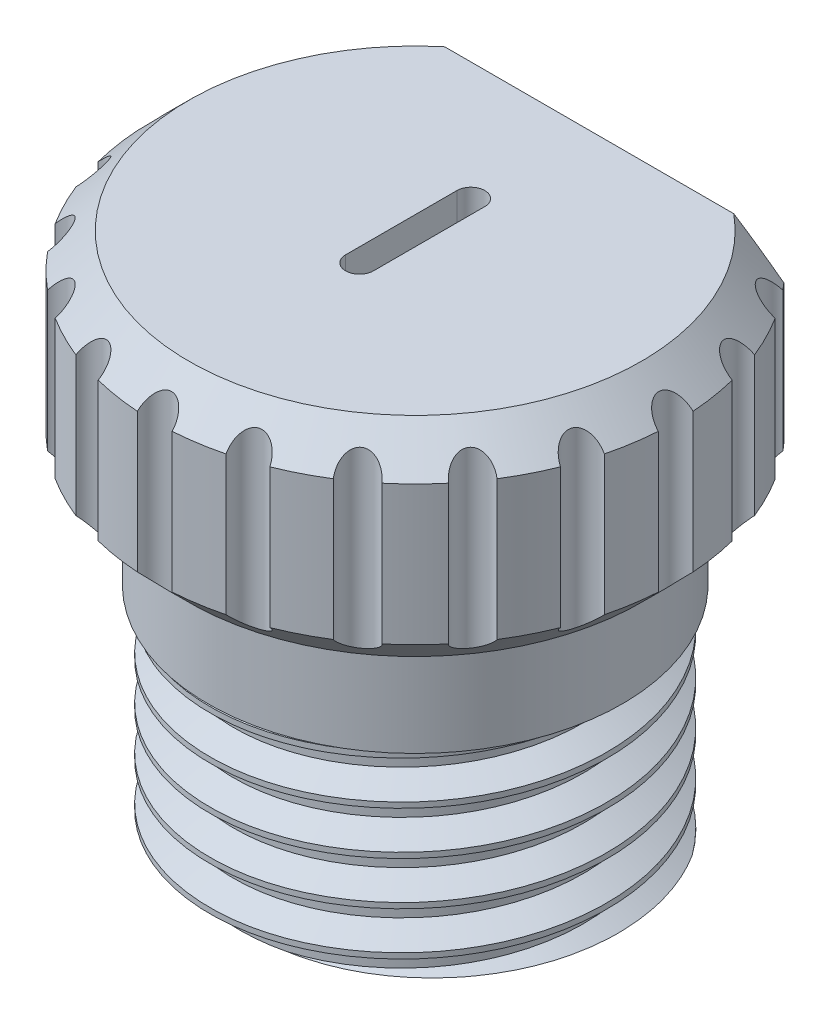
SolidWorks part; units mm, degrees
ref_plane "Front Plane" through (0, 0, 0) normal (0, 0, 1) x (1, 0, 0)
ref_plane "Top Plane" through (0, 0, 0) normal (0, 1, 0) x (1, 0, 0)
ref_plane "Right Plane" through (0, 0, 0) normal (1, 0, 0) x (0, 0, -1)
sketch "Sketch1" plane through (0, 0, 0) normal (0, 1, 0) x (1, 0, 0)
  circle A0 centre (0, 0) radius 7.239
  dimension "D1" = 14.478
extrude "Boss-Extrude1" add sketch "Sketch1" along normal blind 11.303
thread "Thread1" pitch 1.5875 start angle 0, offset 2.54, length 10.795, pitch 1.5875, diameter 14.478
ref_plane "Plane1" through (7.239, -2.54, 0) normal (0, 0, 1) x (1, 0, 0)
sketch "Thread Profile1" plane through (7.239, -2.54, 0) normal (0, 0, 1) x (1, 0, 0)
  line L0 (0, 0) -> (0, 1.5875) construction
  line L11 (0, 0) -> (0, 1.3891)
  line L12 (0, 1.3891) -> (-0.8593, 0.893)
  line L13 (-0.8593, 0.893) -> (-0.8593, 0.4961)
  line L15 (-0.8593, 0.4961) -> (0, 0)
  line L17 (-0.8593, 0.6945) -> (0, 0.6945) construction
  point P2 (0, 0)
  dimension "Pitch" = 1.5875
  dimension "Profile_Angle" = 60
  dimension "Profile_Land" = 0.3969
  dimension "Profile_Height" = 0.8593
sketch "Sketch4" plane through (0, 11.303, 0) normal (0, 1, 0) x (1, 0, 0)
  circle A0 centre (0, 0) radius 9.525
  dimension "D1" = 19.05
extrude "Boss-Extrude2" add sketch "Sketch4" along normal blind 7.62
sketch "Sketch5" plane through (0, 18.923, 0) normal (0, 1, 0) x (1, 0, 0)
  line L0 (0, -2.032) -> (0, 2.032) construction
  line L5 (-0.508, -2.032) -> (-0.508, 2.032)
  line L6 (0.508, -2.032) -> (0.508, 2.032)
  arc A0 (-0.508, -2.032) -> (0.508, -2.032) centre (0, -2.032) ccw
  arc A1 (0.508, 2.032) -> (-0.508, 2.032) centre (0, 2.032) ccw
  point P2 (0, 0)
  dimension "D1" = 1.016
  dimension "D2" = 4.064
extrude "Cut-Extrude1" cut sketch "Sketch5" against normal blind 3.81
chamfer "Chamfer1" distance 1.27 angle 45 1 edges at (0, 11.303, 9.525)
sketch "Sketch7" plane through (0, 0, 0) normal (0, -1, 0) x (1, 0, 0)
  line L0 (0, 0) -> (0, 6.35) construction
  line L1 (7.0995, 6.35) -> (-7.0995, 6.35)
  circle A0 centre (0, 0) radius 9.525 construction
  arc A1 (7.0995, 6.35) -> (-7.0995, 6.35) centre (0, 0) ccw
  point P6 (0, 6.35)
  dimension "D1" = 6.35
extrude "Cut-Extrude2" cut sketch "Sketch7" against normal up to surface (18.923 mm away)
chamfer "Chamfer2" distance 1.27 angle 45 1 edges at (0, 18.923, -9.525)
sketch "Sketch8" plane through (0, 18.923, 0) normal (0, 1, 0) x (1, 0, 0)
  circle A0 centre (0, 0) radius 9.525 construction
  arc A1 (7.0995, -6.35) -> (-7.0995, -6.35) centre (0, 0) ccw construction
  circle A2 centre (0, -9.525) radius 0.635
  circle A3 centre (-2.9434, -9.0588) radius 0.635
  circle A4 centre (-5.5987, -7.7059) radius 0.635
  circle A5 centre (-7.7059, -5.5987) radius 0.635
  circle A6 centre (-9.0588, -2.9434) radius 0.635
  circle A7 centre (-9.525, 0) radius 0.635
  circle A8 centre (-9.0588, 2.9434) radius 0.635
  circle A9 centre (-7.7059, 5.5987) radius 0.635
  circle A10 centre (-5.5987, 7.7059) radius 0.635
  circle A11 centre (-2.9434, 9.0588) radius 0.635
  circle A12 centre (0, 9.525) radius 0.635
  circle A13 centre (2.9434, 9.0588) radius 0.635
  circle A14 centre (5.5987, 7.7059) radius 0.635
  circle A15 centre (7.7059, 5.5987) radius 0.635
  circle A16 centre (9.0588, 2.9434) radius 0.635
  circle A17 centre (9.525, 0) radius 0.635
  circle A18 centre (9.0588, -2.9434) radius 0.635
  circle A19 centre (7.7059, -5.5987) radius 0.635
  circle A20 centre (5.5987, -7.7059) radius 0.635
  circle A21 centre (2.9434, -9.0588) radius 0.635
  point P49 (0, 0)
  dimension "D1" = 1.27
  dimension "D2" = 20
extrude "Cut-Extrude3" cut sketch "Sketch8" against normal up to surface (7.62 mm away)
sketch "Sketch9" plane through (0, 11.303, 0) normal (0, -1, 0) x (1, 0, 0)
  line L1 (4.0961, 6.35) -> (-4.0961, 6.35)
  line L2 (5.2747, 6.35) -> (3.4757, 6.35) construction
  arc A2 (-4.0961, 6.35) -> (4.0961, 6.35) centre (0, 0) ccw
  dimension "D1" = 15.113
extrude "Boss-Extrude3" add sketch "Sketch9" along normal blind 3.556
move or copy body "Body-Move/Copy1" bodies to move or copy 107 copy no rotation origin (0, 0, -1.1755) rotation axis (0, 1, 0) rotation angle 180
